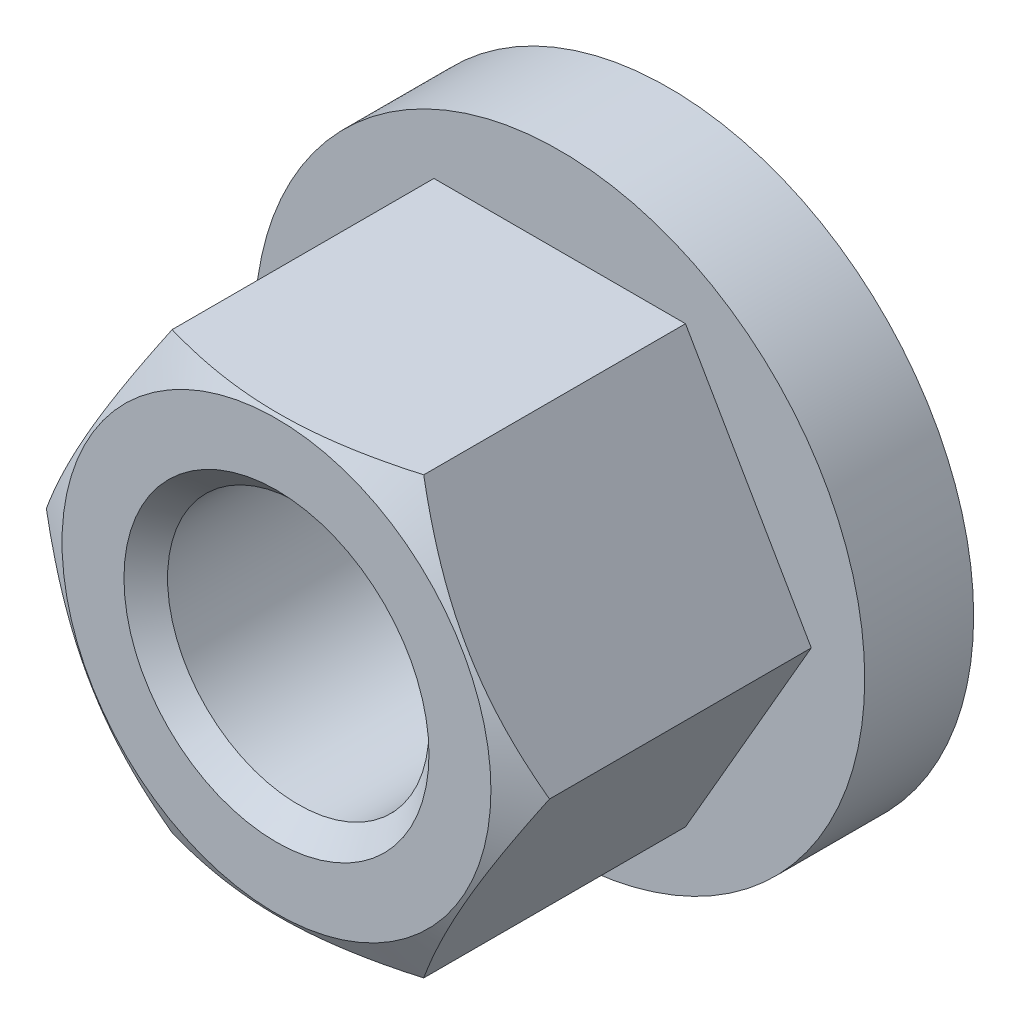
SolidWorks part; units mm, degrees
ref_plane "Plan1" through (0, 0, 0) normal (0, 0, 1) x (1, 0, 0)
ref_plane "Plan2" through (0, 0, 0) normal (0, 1, 0) x (1, 0, 0)
ref_plane "Plan3" through (0, 0, 0) normal (1, 0, 0) x (0, 0, -1)
sketch "Esquisse1" plane through (0, 0, 0) normal (0, 0, 1) x (1, 0, 0)
  circle A0 centre (0, 0) radius 7
  dimension "D2" = 14
extrude "Base-Extrusion" add sketch "Esquisse1" along normal blind 9
chamfer "Chanfrein1" distance 1.2 angle 60 1 edges at (7, 0, 9)
sketch "Esquisse2" plane through (0, 0, 0) normal (0, 0, 1) x (1, 0, 0)
  line L1 (2.8868, -5) -> (5.7735, 0)
  line L2 (5.7735, 0) -> (2.8868, 5)
  line L3 (2.8868, 5) -> (-2.8868, 5)
  line L4 (-2.8868, 5) -> (-5.7735, 0)
  line L5 (-5.7735, 0) -> (-2.8868, -5)
  line L6 (-2.8868, -5) -> (2.8868, -5)
  circle A0 centre (0, 0) radius 5 construction
  dimension "D1" = 10
extrude "Enlèv. mat.-Extru.2" cut sketch "Esquisse2" along normal through all flip side to cut
sketch "Esquisse3" plane through (0, 0, 0) normal (0, 0, 1) x (1, 0, 0)
  circle A0 centre (0, 0) radius 7
  dimension "D1" = 14
extrude "Boss.-Extru.1" add sketch "Esquisse3" along normal blind 2.5
sketch "Esquisse4" plane through (0, 0, 0) normal (0, 0, 1) x (1, 0, 0)
  circle A0 centre (0, 0) radius 3
  dimension "D1" = 6
extrude "Enlèv. mat.-Extru.5" cut sketch "Esquisse4" along normal through all
chamfer "Chanfrein2" distance 0.5 angle 45 2 edges at (3, 0, 0) (3, 0, 9)
equation "\"D1@Chanfrein1\" = \"D1@Esquisse4\"/5"
